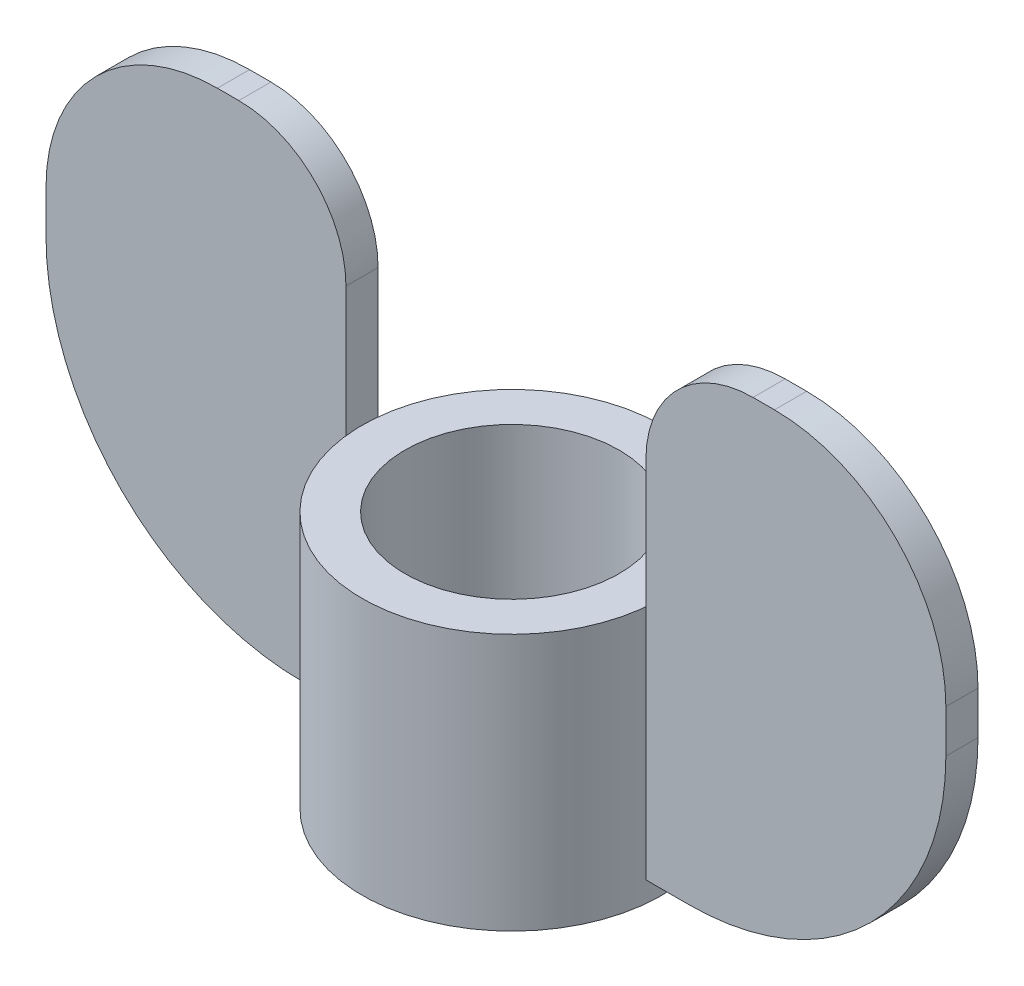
SolidWorks part; units mm, degrees
ref_plane "Front Plane" through (0, 0, 0) normal (0, 0, 1) x (1, 0, 0)
ref_plane "Top Plane" through (0, 0, 0) normal (0, 1, 0) x (1, 0, 0)
ref_plane "Right Plane" through (0, 0, 0) normal (1, 0, 0) x (0, 0, -1)
sketch "Schizzo1" plane through (0, 0, 0) normal (0, 0, 1) x (1, 0, 0)
  line L2 (-7, 10) -> (-7, -10)
  line L3 (-7, -10) -> (7, -10)
  line L4 (7, 10) -> (7, -10)
  line L6 (-7, 10) -> (-7, 12)
  line L7 (-7, 12) -> (7, 12)
  line L8 (7, 10) -> (7, 12)
  dimension "D1" = 14
  dimension "D2" = 20
  dimension "D3" = 7
  dimension "D5" = 2
extrude "Estrusione-Estrusione2" add sketch "Schizzo1" along normal blind 1.5
fillet "Raccordo1" radius 5 1 edges at (7, 12, 0.75)
fillet "Raccordo2" radius 8 1 edges at (-7, 12, 0.75)
fillet "Raccordo3" radius 12 1 edges at (-7, -10, 0.75)
sketch "Schizzo2" plane through (0, -10, 0) normal (0, -1, 0) x (1, 0, 0)
  line L0 (7, 1.5) -> (7, 0) construction
  circle A0 centre (14, 0.75) radius 5
  circle A1 centre (14, 0.75) radius 7
  dimension "D1" = 10
  dimension "D3" = 14
  dimension "D2" = 7
  dimension "D4" = 0.75
extrude "Estrusione-Estrusione3" add sketch "Schizzo2" against normal blind 11 and the other way blind 1 separate body
pattern_circular "RipetizioneCircolare4" count 2 over 360 about axis through (14, 0, 0.75) along (0, 1, 0)
